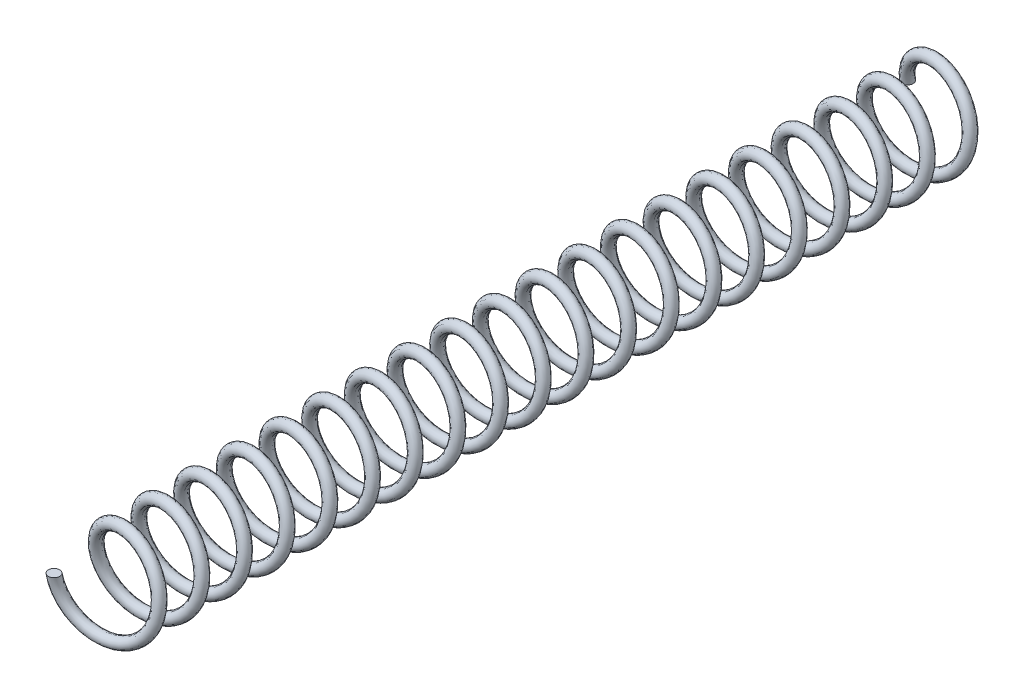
SolidWorks part; units mm, degrees
ref_plane "Front Plane" through (0, 0, 0) normal (0, 0, 1) x (1, 0, 0)
ref_plane "Top Plane" through (0, 0, 0) normal (0, 1, 0) x (1, 0, 0)
ref_plane "Right Plane" through (0, 0, 0) normal (1, 0, 0) x (0, 0, -1)
sketch "Sketch1" plane through (0, 0, 0) normal (0, 0, 1) x (1, 0, 0)
  circle A0 centre (0, 0) radius 12.5
  dimension "D1" = 25
curve "Helix/Spiral1"
sketch "Sketch2" plane through (0, 0, 0) normal (0, 1, 0) x (1, 0, 0)
  circle A3 centre (-11, -225.25) radius 1.5
  spline S0 degree 3 number of poles 323 (-12.5, 0) -> (-12.5, -225.25) construction
  point P4 (-12.5, -225.25)
  dimension "D1" = 3
  dimension "D2" = 11
sweep "Sweep2" add profiles "Sketch2" path "Helix/Spiral1"
